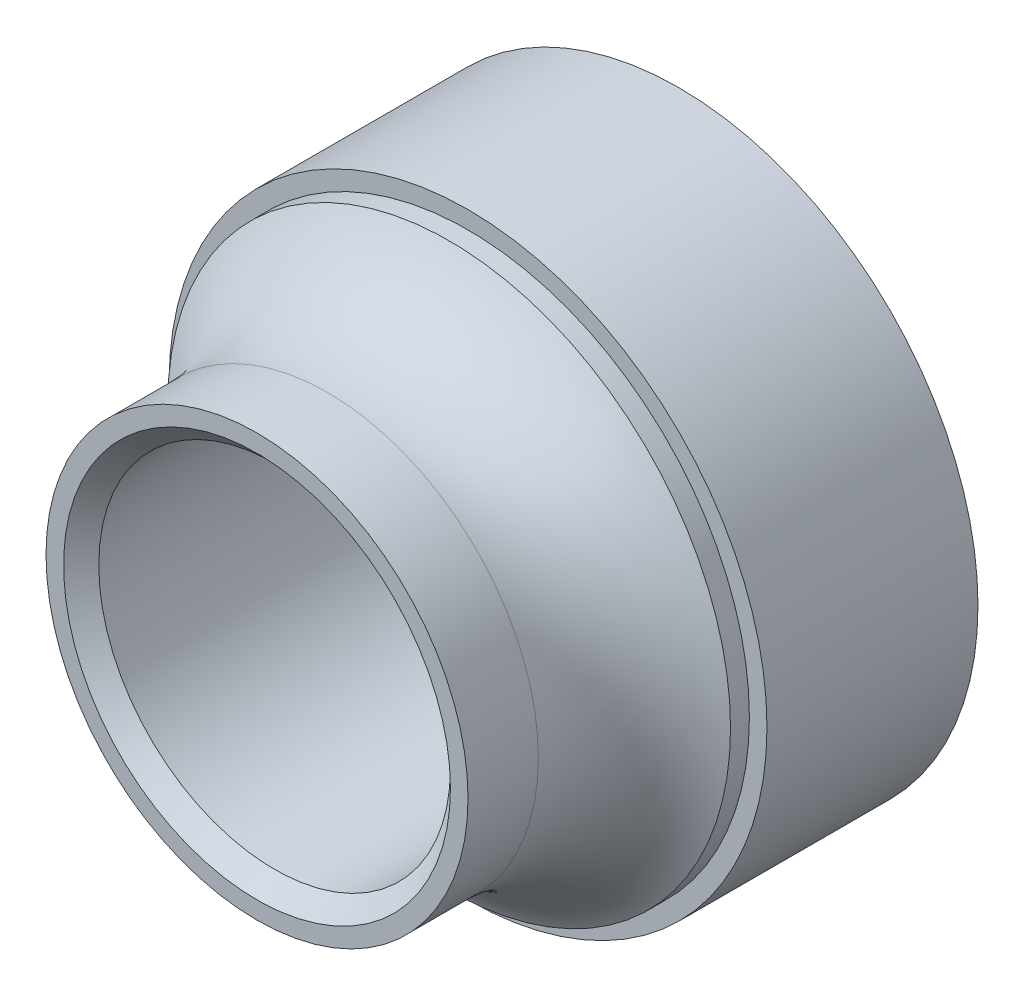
SolidWorks part; units mm, degrees
ref_plane "Спереди" through (0, 0, 0) normal (0, 0, 1) x (1, 0, 0)
ref_plane "Сверху" through (0, 0, 0) normal (0, 1, 0) x (1, 0, 0)
ref_plane "Справа" through (0, 0, 0) normal (1, 0, 0) x (0, 0, -1)
sketch "Эскиз1" plane through (0, 0, 0) normal (0, 0, 1) x (1, 0, 0)
  circle A0 centre (0, 0) radius 8.5
  dimension "D1" = 17
extrude "Вытянуть1" add sketch "Эскиз1" along normal blind 6
sketch "Эскиз2" plane through (0, 0, 6) normal (0, 0, 1) x (1, 0, 0)
  circle A0 centre (0, 0) radius 8
  dimension "D1" = 16
extrude "Вытянуть2" add sketch "Эскиз2" along normal blind 6
sketch "Эскиз3" plane through (0, 0, 0) normal (1, 0, 0) x (0, 0, -1)
  line L0 (-6, 8.5) -> (-6, -8.5) construction
  line L1 (-12, 8) -> (-12, -8) construction
  line L2 (-10, 6) -> (-12, 6)
  line L3 (-12, 6) -> (-12, 8)
  line L4 (-12, 8) -> (-6.5359, 8)
  line L5 (-6, 8) -> (-12, 8) construction
  line L6 (-12, 0) -> (0, 0) construction
  arc A0 (-10, 6) -> (-6.5359, 8) centre (-10, 10) ccw
  dimension "D3" = 8
  dimension "D1" = 4
  dimension "D2" = 10
revolve "Вырез-Повернуть1" cut sketch "Эскиз3" angle 360 about L6
sketch "Эскиз4" plane through (0, 0, 0) normal (0, 0, -1) x (-1, 0, 0)
  circle A0 centre (0, 0) radius 5
  dimension "D1" = 10
extrude "Вырез-Вытянуть1" cut sketch "Эскиз4" against normal blind 96
chamfer "Фаска1" distance 0.5 angle 45 2 edges at (5, 0, 12) (-5, 0, 0)
